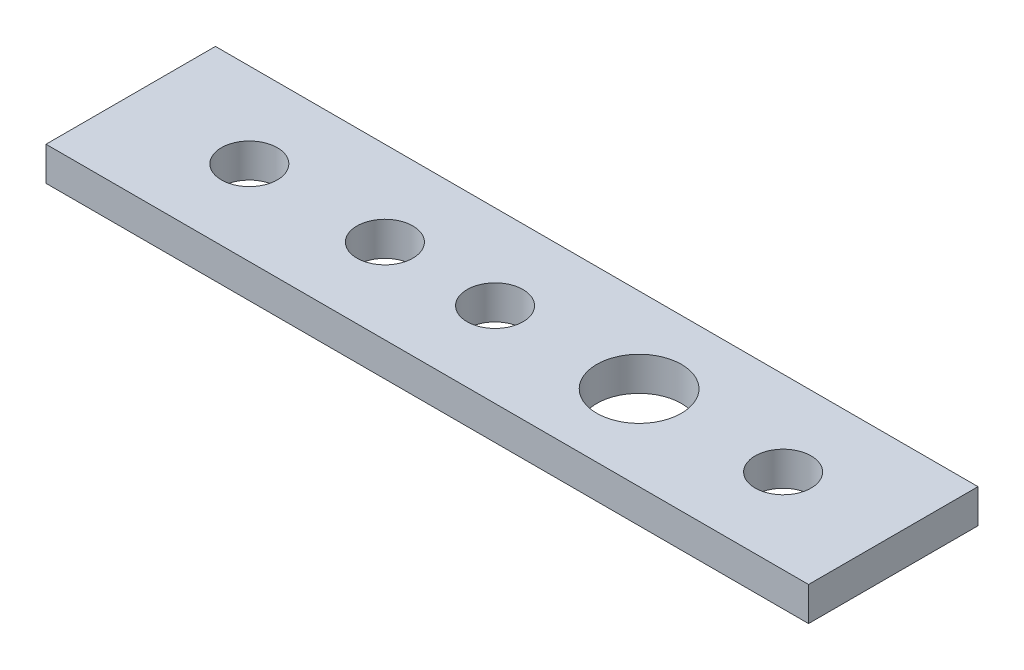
SolidWorks part; units mm, degrees
ref_plane "Front" through (0, 0, 0) normal (0, 0, 1) x (1, 0, 0)
ref_plane "Top" through (0, 0, 0) normal (0, 1, 0) x (1, 0, 0)
ref_plane "Right" through (0, 0, 0) normal (1, 0, 0) x (0, 0, -1)
sketch "草图1" plane through (0, 0, 0) normal (0, 1, 0) x (1, 0, 0)
  line L1 (0, 0) -> (45, 0)
  line L2 (0, 0) -> (0, 10)
  line L3 (0, 10) -> (45, 10)
  line L4 (45, 0) -> (45, 10)
  dimension "D1" = 10
  dimension "D2" = 45
extrude "凸台-拉伸1" add sketch "草图1" along normal blind 2
hole_wizard "Ø3.3 (3.3) 直径孔1" positions "草图2" profile "草图3" hole size "Ø3.3" standard "GB"
sketch "草图2" plane through (0, 2, 0) normal (0, 1, 0) x (1, 0, 0)
  point P0 (21.5, 5)
  point P3 (38.5, 5)
  point P6 (15, 5)
  point P9 (7, 5)
sketch "草图3" plane through (21.5, 2, -5) normal (1, 0, 0) x (0, 0, 1)
  line L0 (0, 0) -> (0, 2)
  line L1 (0, 2) -> (1.65, 2)
  line L2 (1.65, 2) -> (1.65, 0)
  line L5 (1.65, 0) -> (0, 0)
  line L11 (0, -6.35) -> (0, 107.95) construction
  dimension "通孔孔直径" = 3.3
  dimension "通孔孔深度" = 2
hole_wizard "Ø5.0 (5) 直径孔1" positions "草图4" profile "草图5" hole size "Ø5.0" standard "GB"
sketch "草图4" plane through (0, 0, 0) normal (0, -1, 0) x (-1, 0, 0)
  point P0 (-30, 5)
sketch "草图5" plane through (30, 0, -5) normal (1, 0, 0) x (0, 0, -1)
  line L0 (0, 0) -> (0, 2)
  line L1 (0, 2) -> (2.5, 2)
  line L2 (2.5, 2) -> (2.5, 0)
  line L5 (2.5, 0) -> (0, 0)
  line L11 (0, -6.35) -> (0, 107.95) construction
  dimension "通孔孔直径" = 5
  dimension "通孔孔深度" = 2
